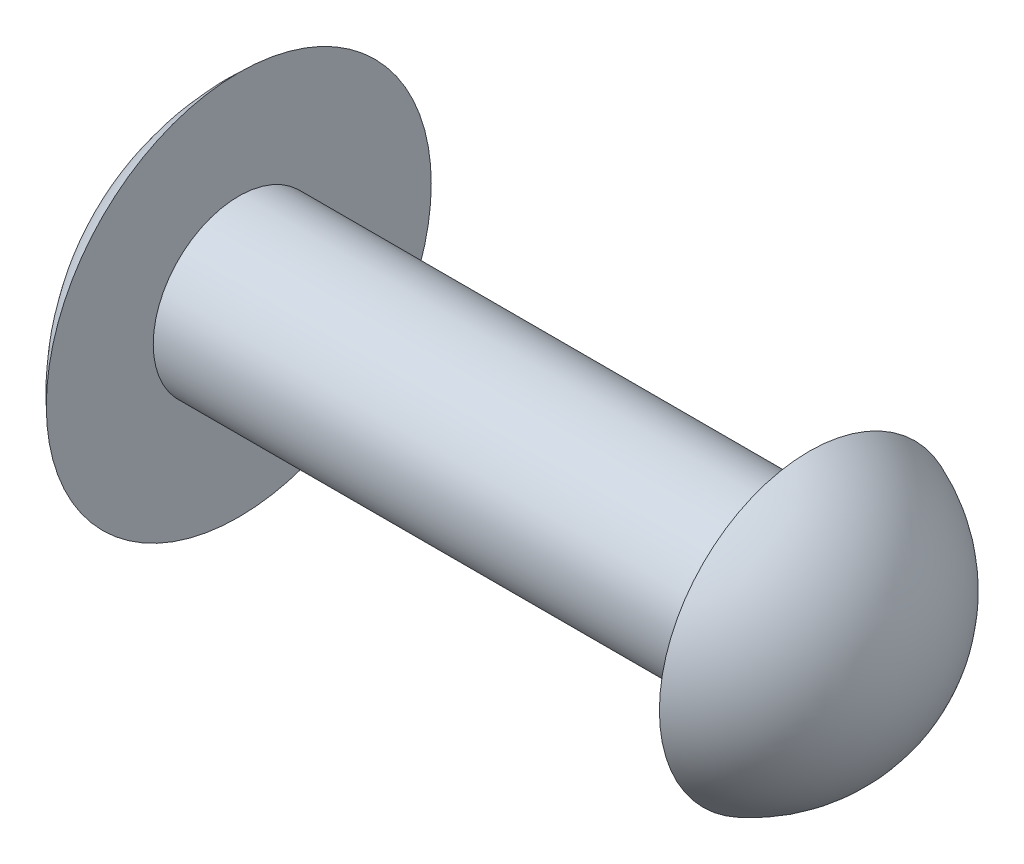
SolidWorks part; units mm, degrees
ref_plane "Plane1" through (0, 0, 0) normal (0, 0, 1) x (1, 0, 0)
ref_plane "Plane2" through (0, 0, 0) normal (0, 1, 0) x (1, 0, 0)
ref_plane "Plane3" through (0, 0, 0) normal (1, 0, 0) x (0, 0, -1)
sketch "Sketch1" plane through (0, 0, 0) normal (0, 0, 1) x (1, 0, 0)
  line L0 (-39, 0) -> (6, 0) construction
  line L1 (-23, 0) -> (0, 0)
  line L2 (-20, 3) -> (-20, 6.75)
  line L3 (-20, 3) -> (0, 3)
  line L4 (0, 3) -> (0, 0)
  arc A0 (-20, 6.75) -> (-23, 0) centre (-13.9063, 0) ccw
  point P12 (-20, 3)
  dimension "Diameter" = 6
  dimension "GripLength" = 20
  dimension "HeadHt" = 3
  dimension "HeadDia" = 13.5
revolve "Base-Revolve" add sketch "Sketch1" angle 360 about L0
sketch "Sketch2" plane through (0, 0, 0) normal (0, 0, 1) x (1, 0, 0)
  line L0 (-49, 0) -> (71, 0) construction
  line L1 (0, 0) -> (3.6, 0)
  line L2 (0, 0) -> (0, 5.25)
  arc A0 (3.6, 0) -> (0, 5.25) centre (-2.0281, 0) ccw
  dimension "HeadDiaA" = 10.5
  dimension "HeadHtA" = 3.6
revolve "HeadTypeA" add sketch "Sketch2" angle 360 about L0
sketch "Sketch3" plane through (0, 0, 0) normal (0, 0, 1) x (1, 0, 0)
  line L0 (30, 0) -> (-54, 0) construction
  line L1 (-39, 0) -> (6, 0) construction
  line L2 (0, 0) -> (0, 5.25)
  line L3 (0, 5.25) -> (-2.9323, 3)
  line L4 (-2.9323, 0) -> (0, 0)
  line L5 (0, -5.25) -> (-2.9323, -3) construction
  line L6 (-2.9323, 0) -> (-2.9323, 3)
  dimension "HeadDiaB" = 10.5
  dimension "D2" = 75
  dimension "D3" = 6
revolve "HeadTypeB" [suppressed] add sketch "Sketch3" angle 360 about L0
equation "\"D3@Sketch3\" = \"Diameter@Sketch1\""
